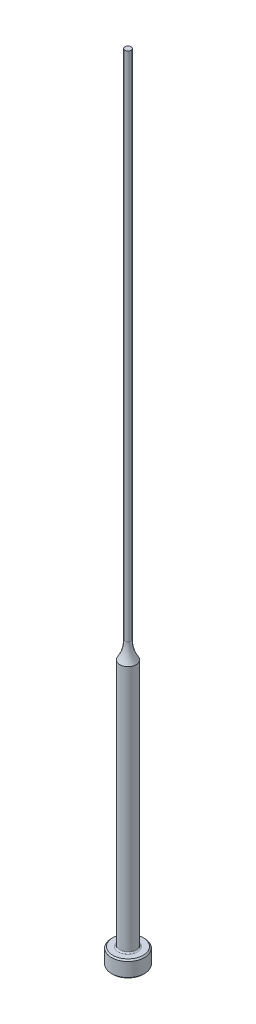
SolidWorks part; units mm, degrees
ref_plane "Front Plane" through (0, 0, 0) normal (0, 0, 1) x (1, 0, 0)
ref_plane "Top Plane" through (0, 0, 0) normal (0, 1, 0) x (1, 0, 0)
ref_plane "Right Plane" through (0, 0, 0) normal (1, 0, 0) x (0, 0, -1)
sketch "Sketch1" plane through (0, 0, 0) normal (0, 0, 1) x (1, 0, 0)
  line L0 (0, 259.9588) -> (0, -15.1925) construction
  line L1 (0, 0) -> (-3.175, 0)
  line L2 (-3.175, 0) -> (-3.175, 3.175)
  line L3 (-3.175, 3.175) -> (-1.5875, 3.175)
  line L4 (-0.5944, 54.2098) -> (-0.5944, 152.4)
  line L5 (-0.5944, 152.4) -> (0, 152.4)
  line L6 (0, 152.4) -> (0, 0)
  line L7 (-1.5875, 3.175) -> (-1.5875, 50.8)
  arc A0 (-1.5875, 50.8) -> (-0.5944, 54.2098) centre (-6.9444, 54.2098) ccw
  point P13 (-1.5875, 0)
  dimension "D1" = 6.35
  dimension "L" = 152.4
  dimension "D2" = 3.175
  dimension "H" = 6.35
  dimension "T" = 3.175
  dimension "D" = 1.1887
  dimension "S" = 50.8
revolve "Revolve1" add sketch "Sketch1" angle 360 about L0
chamfer "Chamfer1" distance 0.254 angle 45 2 edges at (0, 3.175, 3.175) (0, 0, 3.175)
fillet "Fillet1" radius 0.254 1 edges at (0, 3.175, 1.5875)
